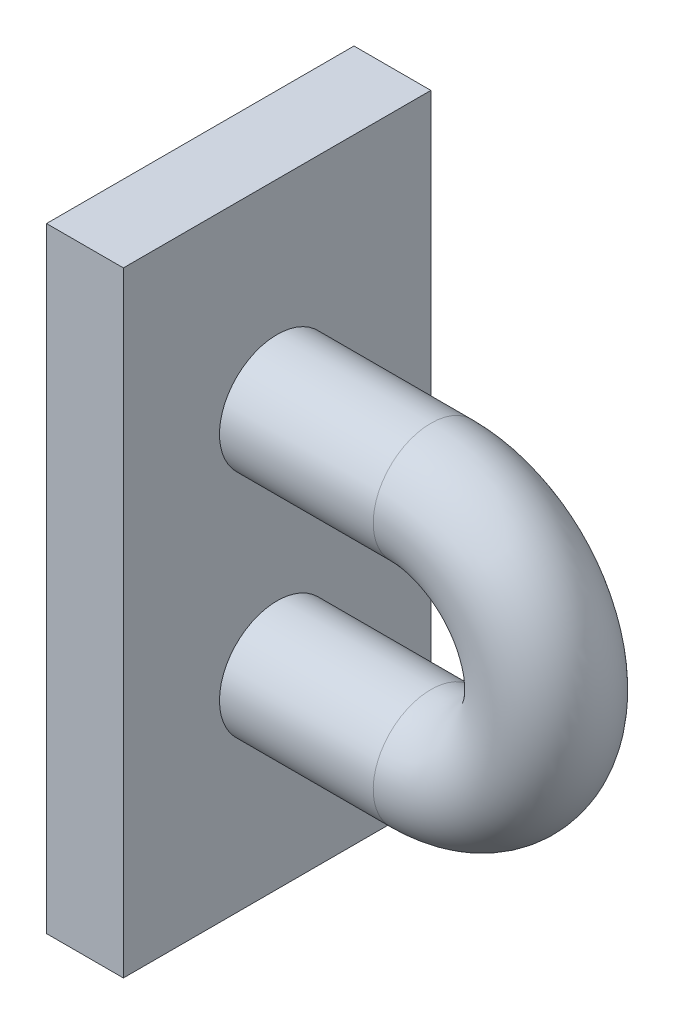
SolidWorks part; units mm, degrees
ref_plane "Plane1" through (0, 0, 0) normal (0, 0, 1) x (1, 0, 0)
ref_plane "Plane2" through (0, 0, 0) normal (0, 1, 0) x (1, 0, 0)
ref_plane "Plane3" through (0, 0, 0) normal (1, 0, 0) x (0, 0, -1)
sketch "Sketch1" plane through (0, 0, 0) normal (0, 0, 1) x (1, 0, 0)
  line L0 (0, 15.0005) -> (-20, 15.0005)
  line L1 (0, -15.0005) -> (-20, -15.0005)
  arc A0 (0, -15.0005) -> (0, 15.0005) centre (0, 0) ccw
  dimension "D1" = 30.001
  dimension "D2" = 20
ref_plane "Plane4" through (-20, 0, 0) normal (1, 0, 0) x (0, 0, -1)
sketch "Sketch2" plane through (-20, 0, 0) normal (1, 0, 0) x (0, 0, -1)
  circle A0 centre (0, -15.0005) radius 7.5
  dimension "D1" = 15
sweep "Base-Sweep" add profiles "Sketch2" path "Sketch1"
sketch "Sketch4" plane through (-20, 0, 0) normal (1, 0, 0) x (0, 0, -1)
  line L1 (20, 40) -> (-20, 40)
  line L2 (20, 40) -> (20, -40)
  line L3 (20, -40) -> (-20, -40)
  line L4 (-20, 40) -> (-20, -40)
  dimension "D1" = 40
  dimension "D2" = 80
extrude "Boss-Extrude1" add sketch "Sketch4" against normal blind 10
